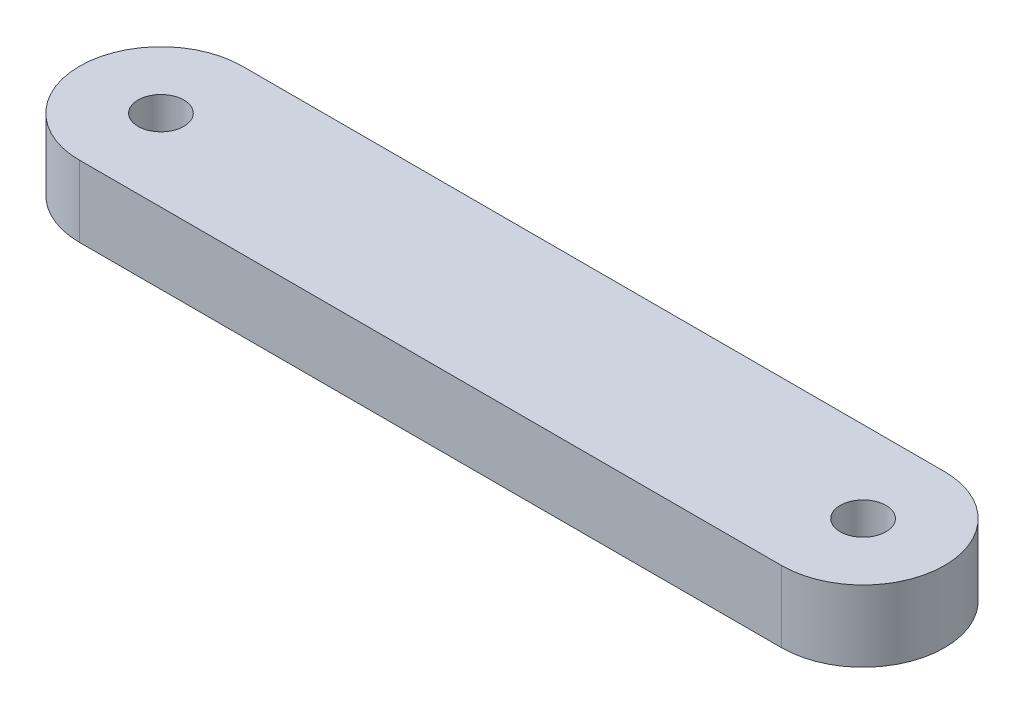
SolidWorks part; units mm, degrees
ref_plane "Front Plane" through (0, 0, 0) normal (0, 0, 1) x (1, 0, 0)
ref_plane "Top Plane" through (0, 0, 0) normal (0, 1, 0) x (1, 0, 0)
ref_plane "Right Plane" through (0, 0, 0) normal (1, 0, 0) x (0, 0, -1)
sketch "Sketch1" plane through (0, 0, 0) normal (0, 1, 0) x (1, 0, 0)
  line L0 (-87.63, 0) -> (87.63, 0) construction
  line L1 (-87.63, 20.32) -> (87.63, 20.32)
  line L2 (-87.63, -20.32) -> (87.63, -20.32)
  arc A0 (-87.63, 20.32) -> (-87.63, -20.32) centre (-87.63, 0) ccw
  arc A1 (87.63, -20.32) -> (87.63, 20.32) centre (87.63, 0) ccw
  circle A3 centre (87.63, 0) radius 5.715
  circle A4 centre (-87.63, 0) radius 5.715
  point P2 (0, 0)
  dimension "D2" = 175.26
  dimension "D5" = 11.43
  dimension "D1" = 20.32
extrude "Boss-Extrude2" add sketch "Sketch1" along normal blind 17.78
